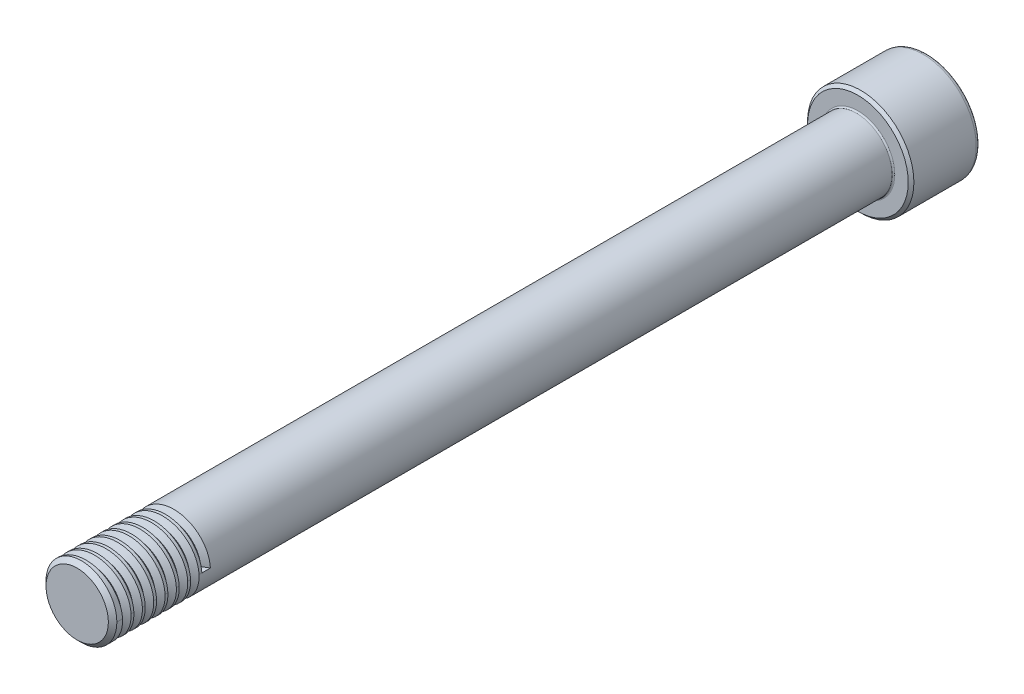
SolidWorks part; units mm, degrees
ref_plane "Front Plane" through (0, 0, 0) normal (0, 0, 1) x (1, 0, 0)
ref_plane "Top Plane" through (0, 0, 0) normal (0, 1, 0) x (1, 0, 0)
ref_plane "Right Plane" through (0, 0, 0) normal (1, 0, 0) x (0, 0, -1)
sketch "Sketch1" plane through (0, 0, 0) normal (0, 0, 1) x (1, 0, 0)
  circle A0 centre (0, 0) radius 3.75
  dimension "D1" = 7.5
extrude "Boss-Extrude1" add sketch "Sketch1" along normal blind 4.9
sketch "Sketch2" plane through (0, 0, 0) normal (0, 0, -1) x (-1, 0, 0)
  line L7 (1.8543, 0) -> (2.6304, 0) construction
  arc A1 (-2, 1.1547) -> (0, 2.3094) centre (-3.2519, 5.6325) ccw
  arc A2 (2, 1.1547) -> (0, 2.3094) centre (3.2519, 5.6325) cw
  arc A3 (2, -1.1547) -> (0, -2.3094) centre (3.2519, -5.6325) ccw
  arc A4 (-2, -1.1547) -> (0, -2.3094) centre (-3.2519, -5.6325) cw
  arc A5 (-2, 1.1547) -> (-2, -1.1547) centre (-6.5038, 0) cw
  arc A6 (2, 1.1547) -> (2, -1.1547) centre (6.5038, 0) ccw
extrude "Cut-Extrude1" cut sketch "Sketch2" against normal blind 3.75
fillet "Fillet1" radius 0.3 1 edges at (3.75, 0, 0)
chamfer "Chamfer2" distance 0.3 angle 45 6 edges at (-0.9272, -1.6059, 3.75) (0.9272, -1.6059, 3.75) (1.8543, 0, 3.75) (0.9272, 1.6059, 3.75) (-0.9272, 1.6059, 3.75) (-1.8543, 0, 3.75)
fillet "Fillet2" radius 0.1 6 edges at (0.9272, 1.6059, 0) (1.8543, 0, 0) (0.9272, -1.6059, 0) (-0.9272, -1.6059, 0) (-1.8543, 0, 0) (-0.9272, 1.6059, 0)
chamfer "Chamfer4" distance 0.2 angle 45 1 edges at (3.75, 0, 4.9)
sketch "Sketch4" plane through (0, 0, 4.9) normal (0, 0, 1) x (1, 0, 0)
  circle A0 centre (0, 0) radius 2.5
  dimension "D1" = 5
extrude "Boss-Extrude2" add sketch "Sketch4" along normal blind 55.1
chamfer "Chamfer5" distance 0.3 angle 45 1 edges at (2.5, 0, 60)
thread "Thread1" pitch 0.8 start angle 0, offset 0, length 6, pitch 0.8, diameter 5
ref_plane "Plane1" through (-2.5, 0, 59.7) normal (0, -1, 0) x (-1, 0, 0)
sketch "Thread Profile1" plane through (-2.5, 0, 59.7) normal (0, -1, 0) x (-1, 0, 0)
  line L0 (0, 0) -> (0, 0.8) construction
  line L1 (0, 0.6) -> (-0.433, 0.35)
  line L2 (-0.433, 0.35) -> (-0.433, 0.25)
  line L3 (-0.433, 0.25) -> (0, 0)
  line L4 (-0.433, 0.3) -> (0, 0.3) construction
  line L11 (0, 0.6) -> (0, 0)
  point P6 (0, 0)
  dimension "Pitch" = 0.8
  dimension "Profile_Angle" = 60
  dimension "Profile_Land" = 0.1
  dimension "Profile_Height" = 0.433
fillet "Fillet3" radius 0.1 1 edges at (2.5, 0, 4.9)
